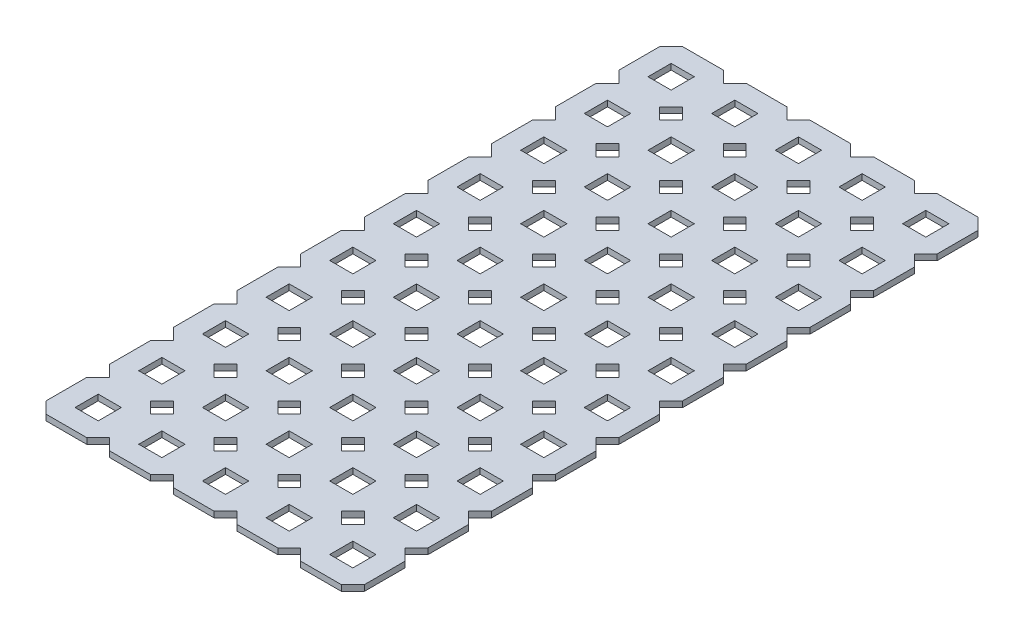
SolidWorks part; units mm, degrees
ref_plane "Front Plane" through (0, 0, 0) normal (0, 0, 1) x (1, 0, 0)
ref_plane "Top Plane" through (0, 0, 0) normal (0, 1, 0) x (1, 0, 0)
ref_plane "Right Plane" through (0, 0, 0) normal (1, 0, 0) x (0, 0, -1)
ref_plane "Plane1" through (0, 1.1684, 0) normal (0, 1, 0) x (1, 0, 0)
sketch "Sketch1" plane through (0, 1.1684, 0) normal (0, 1, 0) x (1, 0, 0)
  line L0 (14.981, 127) -> (12.7, 124.719)
  line L1 (12.7, 124.719) -> (10.419, 127)
  line L2 (10.419, 127) -> (2.281, 127)
  line L3 (2.281, 127) -> (0, 124.719)
  line L4 (0, 124.719) -> (0, 116.581)
  line L5 (0, 116.581) -> (2.281, 114.3)
  line L6 (2.281, 114.3) -> (0, 112.019)
  line L7 (0, 112.019) -> (0, 103.881)
  line L8 (0, 103.881) -> (2.281, 101.6)
  line L9 (2.281, 101.6) -> (0, 99.319)
  line L10 (0, 99.319) -> (0, 91.181)
  line L11 (0, 91.181) -> (2.281, 88.9)
  line L12 (2.281, 88.9) -> (0, 86.619)
  line L13 (0, 86.619) -> (0, 78.481)
  line L14 (0, 78.481) -> (2.281, 76.2)
  line L15 (2.281, 76.2) -> (0, 73.919)
  line L16 (0, 73.919) -> (0, 65.781)
  line L17 (0, 65.781) -> (2.281, 63.5)
  line L18 (2.281, 63.5) -> (0, 61.219)
  line L19 (0, 61.219) -> (0, 53.081)
  line L20 (0, 53.081) -> (2.281, 50.8)
  line L21 (2.281, 50.8) -> (0, 48.519)
  line L22 (0, 48.519) -> (0, 40.381)
  line L23 (0, 40.381) -> (2.281, 38.1)
  line L24 (2.281, 38.1) -> (0, 35.819)
  line L25 (0, 35.819) -> (0, 27.681)
  line L26 (0, 27.681) -> (2.281, 25.4)
  line L27 (2.281, 25.4) -> (0, 23.119)
  line L28 (0, 23.119) -> (0, 14.981)
  line L29 (0, 14.981) -> (2.281, 12.7)
  line L30 (2.281, 12.7) -> (0, 10.419)
  line L31 (0, 10.419) -> (0, 2.281)
  line L32 (0, 2.281) -> (2.281, 0)
  line L33 (2.281, 0) -> (10.419, 0)
  line L34 (10.419, 0) -> (12.7, 2.281)
  line L35 (12.7, 2.281) -> (14.981, 0)
  line L36 (14.981, 0) -> (23.119, 0)
  line L37 (23.119, 0) -> (25.4, 2.281)
  line L38 (25.4, 2.281) -> (27.681, 0)
  line L39 (27.681, 0) -> (35.819, 0)
  line L40 (35.819, 0) -> (38.1, 2.281)
  line L41 (38.1, 2.281) -> (40.381, 0)
  line L42 (40.381, 0) -> (48.519, 0)
  line L43 (48.519, 0) -> (50.8, 2.281)
  line L44 (50.8, 2.281) -> (53.081, 0)
  line L45 (53.081, 0) -> (61.219, 0)
  line L46 (61.219, 0) -> (63.5, 2.281)
  line L47 (63.5, 2.281) -> (63.5, 10.419)
  line L48 (63.5, 10.419) -> (61.219, 12.7)
  line L49 (61.219, 12.7) -> (63.5, 14.981)
  line L50 (63.5, 14.981) -> (63.5, 23.119)
  line L51 (63.5, 23.119) -> (61.219, 25.4)
  line L52 (61.219, 25.4) -> (63.5, 27.681)
  line L53 (63.5, 27.681) -> (63.5, 35.819)
  line L54 (63.5, 35.819) -> (61.219, 38.1)
  line L55 (61.219, 38.1) -> (63.5, 40.381)
  line L56 (63.5, 40.381) -> (63.5, 48.519)
  line L57 (63.5, 48.519) -> (61.219, 50.8)
  line L58 (61.219, 50.8) -> (63.5, 53.081)
  line L59 (63.5, 53.081) -> (63.5, 61.219)
  line L60 (63.5, 61.219) -> (61.219, 63.5)
  line L61 (61.219, 63.5) -> (63.5, 65.781)
  line L62 (63.5, 65.781) -> (63.5, 73.919)
  line L63 (63.5, 73.919) -> (61.219, 76.2)
  line L64 (61.219, 76.2) -> (63.5, 78.481)
  line L65 (63.5, 78.481) -> (63.5, 86.619)
  line L66 (63.5, 86.619) -> (61.219, 88.9)
  line L67 (61.219, 88.9) -> (63.5, 91.181)
  line L68 (63.5, 91.181) -> (63.5, 99.319)
  line L69 (63.5, 99.319) -> (61.219, 101.6)
  line L70 (61.219, 101.6) -> (63.5, 103.881)
  line L71 (63.5, 103.881) -> (63.5, 112.019)
  line L72 (63.5, 112.019) -> (61.219, 114.3)
  line L73 (61.219, 114.3) -> (63.5, 116.581)
  line L74 (63.5, 116.581) -> (63.5, 124.719)
  line L75 (63.5, 124.719) -> (61.219, 127)
  line L76 (61.219, 127) -> (53.081, 127)
  line L77 (53.081, 127) -> (50.8, 124.719)
  line L78 (50.8, 124.719) -> (48.519, 127)
  line L79 (48.519, 127) -> (40.381, 127)
  line L80 (40.381, 127) -> (38.1, 124.719)
  line L81 (38.1, 124.719) -> (35.819, 127)
  line L82 (35.819, 127) -> (27.681, 127)
  line L83 (27.681, 127) -> (25.4, 124.719)
  line L84 (25.4, 124.719) -> (23.119, 127)
  line L85 (23.119, 127) -> (14.981, 127)
  line L86 (12.7, 112.019) -> (10.419, 114.3)
  line L87 (10.419, 114.3) -> (12.7, 116.581)
  line L88 (12.7, 116.581) -> (14.981, 114.3)
  line L89 (14.981, 114.3) -> (12.7, 112.019)
  line L90 (12.7, 86.619) -> (10.419, 88.9)
  line L91 (10.419, 88.9) -> (12.7, 91.181)
  line L92 (12.7, 91.181) -> (14.981, 88.9)
  line L93 (14.981, 88.9) -> (12.7, 86.619)
  line L94 (12.7, 61.219) -> (10.419, 63.5)
  line L95 (10.419, 63.5) -> (12.7, 65.781)
  line L96 (12.7, 65.781) -> (14.981, 63.5)
  line L97 (14.981, 63.5) -> (12.7, 61.219)
  line L98 (12.7, 35.819) -> (10.419, 38.1)
  line L99 (10.419, 38.1) -> (12.7, 40.381)
  line L100 (12.7, 40.381) -> (14.981, 38.1)
  line L101 (14.981, 38.1) -> (12.7, 35.819)
  line L102 (12.7, 10.419) -> (10.419, 12.7)
  line L103 (10.419, 12.7) -> (12.7, 14.981)
  line L104 (12.7, 14.981) -> (14.981, 12.7)
  line L105 (14.981, 12.7) -> (12.7, 10.419)
  line L106 (25.4, 112.019) -> (23.119, 114.3)
  line L107 (23.119, 114.3) -> (25.4, 116.581)
  line L108 (25.4, 116.581) -> (27.681, 114.3)
  line L109 (27.681, 114.3) -> (25.4, 112.019)
  line L110 (25.4, 86.619) -> (23.119, 88.9)
  line L111 (23.119, 88.9) -> (25.4, 91.181)
  line L112 (25.4, 91.181) -> (27.681, 88.9)
  line L113 (27.681, 88.9) -> (25.4, 86.619)
  line L114 (25.4, 61.219) -> (23.119, 63.5)
  line L115 (23.119, 63.5) -> (25.4, 65.781)
  line L116 (25.4, 65.781) -> (27.681, 63.5)
  line L117 (27.681, 63.5) -> (25.4, 61.219)
  line L118 (25.4, 35.819) -> (23.119, 38.1)
  line L119 (23.119, 38.1) -> (25.4, 40.381)
  line L120 (25.4, 40.381) -> (27.681, 38.1)
  line L121 (27.681, 38.1) -> (25.4, 35.819)
  line L122 (25.4, 10.419) -> (23.119, 12.7)
  line L123 (23.119, 12.7) -> (25.4, 14.981)
  line L124 (25.4, 14.981) -> (27.681, 12.7)
  line L125 (27.681, 12.7) -> (25.4, 10.419)
  line L126 (38.1, 112.019) -> (35.819, 114.3)
  line L127 (35.819, 114.3) -> (38.1, 116.581)
  line L128 (38.1, 116.581) -> (40.381, 114.3)
  line L129 (40.381, 114.3) -> (38.1, 112.019)
  line L130 (38.1, 86.619) -> (35.819, 88.9)
  line L131 (35.819, 88.9) -> (38.1, 91.181)
  line L132 (38.1, 91.181) -> (40.381, 88.9)
  line L133 (40.381, 88.9) -> (38.1, 86.619)
  line L134 (38.1, 61.219) -> (35.819, 63.5)
  line L135 (35.819, 63.5) -> (38.1, 65.781)
  line L136 (38.1, 65.781) -> (40.381, 63.5)
  line L137 (40.381, 63.5) -> (38.1, 61.219)
  line L138 (38.1, 35.819) -> (35.819, 38.1)
  line L139 (35.819, 38.1) -> (38.1, 40.381)
  line L140 (38.1, 40.381) -> (40.381, 38.1)
  line L141 (40.381, 38.1) -> (38.1, 35.819)
  line L142 (38.1, 10.419) -> (35.819, 12.7)
  line L143 (35.819, 12.7) -> (38.1, 14.981)
  line L144 (38.1, 14.981) -> (40.381, 12.7)
  line L145 (40.381, 12.7) -> (38.1, 10.419)
  line L146 (50.8, 112.019) -> (48.519, 114.3)
  line L147 (48.519, 114.3) -> (50.8, 116.581)
  line L148 (50.8, 116.581) -> (53.081, 114.3)
  line L149 (53.081, 114.3) -> (50.8, 112.019)
  line L150 (50.8, 86.619) -> (48.519, 88.9)
  line L151 (48.519, 88.9) -> (50.8, 91.181)
  line L152 (50.8, 91.181) -> (53.081, 88.9)
  line L153 (53.081, 88.9) -> (50.8, 86.619)
  line L154 (50.8, 61.219) -> (48.519, 63.5)
  line L155 (48.519, 63.5) -> (50.8, 65.781)
  line L156 (50.8, 65.781) -> (53.081, 63.5)
  line L157 (53.081, 63.5) -> (50.8, 61.219)
  line L158 (50.8, 35.819) -> (48.519, 38.1)
  line L159 (48.519, 38.1) -> (50.8, 40.381)
  line L160 (50.8, 40.381) -> (53.081, 38.1)
  line L161 (53.081, 38.1) -> (50.8, 35.819)
  line L162 (50.8, 10.419) -> (48.519, 12.7)
  line L163 (48.519, 12.7) -> (50.8, 14.981)
  line L164 (50.8, 14.981) -> (53.081, 12.7)
  line L165 (53.081, 12.7) -> (50.8, 10.419)
  line L166 (8.6614, 122.9614) -> (8.6614, 118.3386)
  line L167 (8.6614, 118.3386) -> (4.0386, 118.3386)
  line L168 (4.0386, 118.3386) -> (4.0386, 122.9614)
  line L169 (4.0386, 122.9614) -> (8.6614, 122.9614)
  line L170 (21.3614, 122.9614) -> (21.3614, 118.3386)
  line L171 (21.3614, 118.3386) -> (16.7386, 118.3386)
  line L172 (16.7386, 118.3386) -> (16.7386, 122.9614)
  line L173 (16.7386, 122.9614) -> (21.3614, 122.9614)
  line L174 (34.0614, 122.9614) -> (34.0614, 118.3386)
  line L175 (34.0614, 118.3386) -> (29.4386, 118.3386)
  line L176 (29.4386, 118.3386) -> (29.4386, 122.9614)
  line L177 (29.4386, 122.9614) -> (34.0614, 122.9614)
  line L178 (46.7614, 122.9614) -> (46.7614, 118.3386)
  line L179 (46.7614, 118.3386) -> (42.1386, 118.3386)
  line L180 (42.1386, 118.3386) -> (42.1386, 122.9614)
  line L181 (42.1386, 122.9614) -> (46.7614, 122.9614)
  line L182 (59.4614, 122.9614) -> (59.4614, 118.3386)
  line L183 (59.4614, 118.3386) -> (54.8386, 118.3386)
  line L184 (54.8386, 118.3386) -> (54.8386, 122.9614)
  line L185 (54.8386, 122.9614) -> (59.4614, 122.9614)
  line L186 (8.6614, 110.2614) -> (8.6614, 105.6386)
  line L187 (8.6614, 105.6386) -> (4.0386, 105.6386)
  line L188 (4.0386, 105.6386) -> (4.0386, 110.2614)
  line L189 (4.0386, 110.2614) -> (8.6614, 110.2614)
  line L190 (59.4614, 110.2614) -> (59.4614, 105.6386)
  line L191 (59.4614, 105.6386) -> (54.8386, 105.6386)
  line L192 (54.8386, 105.6386) -> (54.8386, 110.2614)
  line L193 (54.8386, 110.2614) -> (59.4614, 110.2614)
  line L194 (8.6614, 97.5614) -> (8.6614, 92.9386)
  line L195 (8.6614, 92.9386) -> (4.0386, 92.9386)
  line L196 (4.0386, 92.9386) -> (4.0386, 97.5614)
  line L197 (4.0386, 97.5614) -> (8.6614, 97.5614)
  line L198 (59.4614, 97.5614) -> (59.4614, 92.9386)
  line L199 (59.4614, 92.9386) -> (54.8386, 92.9386)
  line L200 (54.8386, 92.9386) -> (54.8386, 97.5614)
  line L201 (54.8386, 97.5614) -> (59.4614, 97.5614)
  line L202 (8.6614, 84.8614) -> (8.6614, 80.2386)
  line L203 (8.6614, 80.2386) -> (4.0386, 80.2386)
  line L204 (4.0386, 80.2386) -> (4.0386, 84.8614)
  line L205 (4.0386, 84.8614) -> (8.6614, 84.8614)
  line L206 (59.4614, 84.8614) -> (59.4614, 80.2386)
  line L207 (59.4614, 80.2386) -> (54.8386, 80.2386)
  line L208 (54.8386, 80.2386) -> (54.8386, 84.8614)
  line L209 (54.8386, 84.8614) -> (59.4614, 84.8614)
  line L210 (8.6614, 72.1614) -> (8.6614, 67.5386)
  line L211 (8.6614, 67.5386) -> (4.0386, 67.5386)
  line L212 (4.0386, 67.5386) -> (4.0386, 72.1614)
  line L213 (4.0386, 72.1614) -> (8.6614, 72.1614)
  line L214 (59.4614, 72.1614) -> (59.4614, 67.5386)
  line L215 (59.4614, 67.5386) -> (54.8386, 67.5386)
  line L216 (54.8386, 67.5386) -> (54.8386, 72.1614)
  line L217 (54.8386, 72.1614) -> (59.4614, 72.1614)
  line L218 (8.6614, 59.4614) -> (8.6614, 54.8386)
  line L219 (8.6614, 54.8386) -> (4.0386, 54.8386)
  line L220 (4.0386, 54.8386) -> (4.0386, 59.4614)
  line L221 (4.0386, 59.4614) -> (8.6614, 59.4614)
  line L222 (59.4614, 59.4614) -> (59.4614, 54.8386)
  line L223 (59.4614, 54.8386) -> (54.8386, 54.8386)
  line L224 (54.8386, 54.8386) -> (54.8386, 59.4614)
  line L225 (54.8386, 59.4614) -> (59.4614, 59.4614)
  line L226 (8.6614, 46.7614) -> (8.6614, 42.1386)
  line L227 (8.6614, 42.1386) -> (4.0386, 42.1386)
  line L228 (4.0386, 42.1386) -> (4.0386, 46.7614)
  line L229 (4.0386, 46.7614) -> (8.6614, 46.7614)
  line L230 (59.4614, 46.7614) -> (59.4614, 42.1386)
  line L231 (59.4614, 42.1386) -> (54.8386, 42.1386)
  line L232 (54.8386, 42.1386) -> (54.8386, 46.7614)
  line L233 (54.8386, 46.7614) -> (59.4614, 46.7614)
  line L234 (8.6614, 34.0614) -> (8.6614, 29.4386)
  line L235 (8.6614, 29.4386) -> (4.0386, 29.4386)
  line L236 (4.0386, 29.4386) -> (4.0386, 34.0614)
  line L237 (4.0386, 34.0614) -> (8.6614, 34.0614)
  line L238 (59.4614, 34.0614) -> (59.4614, 29.4386)
  line L239 (59.4614, 29.4386) -> (54.8386, 29.4386)
  line L240 (54.8386, 29.4386) -> (54.8386, 34.0614)
  line L241 (54.8386, 34.0614) -> (59.4614, 34.0614)
  line L242 (8.6614, 21.3614) -> (8.6614, 16.7386)
  line L243 (8.6614, 16.7386) -> (4.0386, 16.7386)
  line L244 (4.0386, 16.7386) -> (4.0386, 21.3614)
  line L245 (4.0386, 21.3614) -> (8.6614, 21.3614)
  line L246 (59.4614, 21.3614) -> (59.4614, 16.7386)
  line L247 (59.4614, 16.7386) -> (54.8386, 16.7386)
  line L248 (54.8386, 16.7386) -> (54.8386, 21.3614)
  line L249 (54.8386, 21.3614) -> (59.4614, 21.3614)
  line L250 (8.6614, 8.6614) -> (8.6614, 4.0386)
  line L251 (8.6614, 4.0386) -> (4.0386, 4.0386)
  line L252 (4.0386, 4.0386) -> (4.0386, 8.6614)
  line L253 (4.0386, 8.6614) -> (8.6614, 8.6614)
  line L254 (21.3614, 8.6614) -> (21.3614, 4.0386)
  line L255 (21.3614, 4.0386) -> (16.7386, 4.0386)
  line L256 (16.7386, 4.0386) -> (16.7386, 8.6614)
  line L257 (16.7386, 8.6614) -> (21.3614, 8.6614)
  line L258 (34.0614, 8.6614) -> (34.0614, 4.0386)
  line L259 (34.0614, 4.0386) -> (29.4386, 4.0386)
  line L260 (29.4386, 4.0386) -> (29.4386, 8.6614)
  line L261 (29.4386, 8.6614) -> (34.0614, 8.6614)
  line L262 (21.3614, 110.2614) -> (21.3614, 105.6386)
  line L263 (21.3614, 105.6386) -> (16.7386, 105.6386)
  line L264 (16.7386, 105.6386) -> (16.7386, 110.2614)
  line L265 (16.7386, 110.2614) -> (21.3614, 110.2614)
  line L266 (34.0614, 110.2614) -> (34.0614, 105.6386)
  line L267 (34.0614, 105.6386) -> (29.4386, 105.6386)
  line L268 (29.4386, 105.6386) -> (29.4386, 110.2614)
  line L269 (29.4386, 110.2614) -> (34.0614, 110.2614)
  line L270 (46.7614, 110.2614) -> (46.7614, 105.6386)
  line L271 (46.7614, 105.6386) -> (42.1386, 105.6386)
  line L272 (42.1386, 105.6386) -> (42.1386, 110.2614)
  line L273 (42.1386, 110.2614) -> (46.7614, 110.2614)
  line L274 (21.3614, 97.5614) -> (21.3614, 92.9386)
  line L275 (21.3614, 92.9386) -> (16.7386, 92.9386)
  line L276 (16.7386, 92.9386) -> (16.7386, 97.5614)
  line L277 (16.7386, 97.5614) -> (21.3614, 97.5614)
  line L278 (34.0614, 97.5614) -> (34.0614, 92.9386)
  line L279 (34.0614, 92.9386) -> (29.4386, 92.9386)
  line L280 (29.4386, 92.9386) -> (29.4386, 97.5614)
  line L281 (29.4386, 97.5614) -> (34.0614, 97.5614)
  line L282 (46.7614, 97.5614) -> (46.7614, 92.9386)
  line L283 (46.7614, 92.9386) -> (42.1386, 92.9386)
  line L284 (42.1386, 92.9386) -> (42.1386, 97.5614)
  line L285 (42.1386, 97.5614) -> (46.7614, 97.5614)
  line L286 (21.3614, 84.8614) -> (21.3614, 80.2386)
  line L287 (21.3614, 80.2386) -> (16.7386, 80.2386)
  line L288 (16.7386, 80.2386) -> (16.7386, 84.8614)
  line L289 (16.7386, 84.8614) -> (21.3614, 84.8614)
  line L290 (34.0614, 84.8614) -> (34.0614, 80.2386)
  line L291 (34.0614, 80.2386) -> (29.4386, 80.2386)
  line L292 (29.4386, 80.2386) -> (29.4386, 84.8614)
  line L293 (29.4386, 84.8614) -> (34.0614, 84.8614)
  line L294 (46.7614, 84.8614) -> (46.7614, 80.2386)
  line L295 (46.7614, 80.2386) -> (42.1386, 80.2386)
  line L296 (42.1386, 80.2386) -> (42.1386, 84.8614)
  line L297 (42.1386, 84.8614) -> (46.7614, 84.8614)
  line L298 (21.3614, 72.1614) -> (21.3614, 67.5386)
  line L299 (21.3614, 67.5386) -> (16.7386, 67.5386)
  line L300 (16.7386, 67.5386) -> (16.7386, 72.1614)
  line L301 (16.7386, 72.1614) -> (21.3614, 72.1614)
  line L302 (34.0614, 72.1614) -> (34.0614, 67.5386)
  line L303 (34.0614, 67.5386) -> (29.4386, 67.5386)
  line L304 (29.4386, 67.5386) -> (29.4386, 72.1614)
  line L305 (29.4386, 72.1614) -> (34.0614, 72.1614)
  line L306 (46.7614, 72.1614) -> (46.7614, 67.5386)
  line L307 (46.7614, 67.5386) -> (42.1386, 67.5386)
  line L308 (42.1386, 67.5386) -> (42.1386, 72.1614)
  line L309 (42.1386, 72.1614) -> (46.7614, 72.1614)
  line L310 (21.3614, 59.4614) -> (21.3614, 54.8386)
  line L311 (21.3614, 54.8386) -> (16.7386, 54.8386)
  line L312 (16.7386, 54.8386) -> (16.7386, 59.4614)
  line L313 (16.7386, 59.4614) -> (21.3614, 59.4614)
  line L314 (34.0614, 59.4614) -> (34.0614, 54.8386)
  line L315 (34.0614, 54.8386) -> (29.4386, 54.8386)
  line L316 (29.4386, 54.8386) -> (29.4386, 59.4614)
  line L317 (29.4386, 59.4614) -> (34.0614, 59.4614)
  line L318 (46.7614, 59.4614) -> (46.7614, 54.8386)
  line L319 (46.7614, 54.8386) -> (42.1386, 54.8386)
  line L320 (42.1386, 54.8386) -> (42.1386, 59.4614)
  line L321 (42.1386, 59.4614) -> (46.7614, 59.4614)
  line L322 (21.3614, 46.7614) -> (21.3614, 42.1386)
  line L323 (21.3614, 42.1386) -> (16.7386, 42.1386)
  line L324 (16.7386, 42.1386) -> (16.7386, 46.7614)
  line L325 (16.7386, 46.7614) -> (21.3614, 46.7614)
  line L326 (34.0614, 46.7614) -> (34.0614, 42.1386)
  line L327 (34.0614, 42.1386) -> (29.4386, 42.1386)
  line L328 (29.4386, 42.1386) -> (29.4386, 46.7614)
  line L329 (29.4386, 46.7614) -> (34.0614, 46.7614)
  line L330 (46.7614, 46.7614) -> (46.7614, 42.1386)
  line L331 (46.7614, 42.1386) -> (42.1386, 42.1386)
  line L332 (42.1386, 42.1386) -> (42.1386, 46.7614)
  line L333 (42.1386, 46.7614) -> (46.7614, 46.7614)
  line L334 (21.3614, 34.0614) -> (21.3614, 29.4386)
  line L335 (21.3614, 29.4386) -> (16.7386, 29.4386)
  line L336 (16.7386, 29.4386) -> (16.7386, 34.0614)
  line L337 (16.7386, 34.0614) -> (21.3614, 34.0614)
  line L338 (34.0614, 34.0614) -> (34.0614, 29.4386)
  line L339 (34.0614, 29.4386) -> (29.4386, 29.4386)
  line L340 (29.4386, 29.4386) -> (29.4386, 34.0614)
  line L341 (29.4386, 34.0614) -> (34.0614, 34.0614)
  line L342 (46.7614, 34.0614) -> (46.7614, 29.4386)
  line L343 (46.7614, 29.4386) -> (42.1386, 29.4386)
  line L344 (42.1386, 29.4386) -> (42.1386, 34.0614)
  line L345 (42.1386, 34.0614) -> (46.7614, 34.0614)
  line L346 (21.3614, 21.3614) -> (21.3614, 16.7386)
  line L347 (21.3614, 16.7386) -> (16.7386, 16.7386)
  line L348 (16.7386, 16.7386) -> (16.7386, 21.3614)
  line L349 (16.7386, 21.3614) -> (21.3614, 21.3614)
  line L350 (34.0614, 21.3614) -> (34.0614, 16.7386)
  line L351 (34.0614, 16.7386) -> (29.4386, 16.7386)
  line L352 (29.4386, 16.7386) -> (29.4386, 21.3614)
  line L353 (29.4386, 21.3614) -> (34.0614, 21.3614)
  line L354 (59.4614, 8.6614) -> (59.4614, 4.0386)
  line L355 (59.4614, 4.0386) -> (54.8386, 4.0386)
  line L356 (54.8386, 4.0386) -> (54.8386, 8.6614)
  line L357 (54.8386, 8.6614) -> (59.4614, 8.6614)
  line L358 (46.7614, 21.3614) -> (46.7614, 16.7386)
  line L359 (46.7614, 16.7386) -> (42.1386, 16.7386)
  line L360 (42.1386, 16.7386) -> (42.1386, 21.3614)
  line L361 (42.1386, 21.3614) -> (46.7614, 21.3614)
  line L362 (46.7614, 8.6614) -> (46.7614, 4.0386)
  line L363 (46.7614, 4.0386) -> (42.1386, 4.0386)
  line L364 (42.1386, 4.0386) -> (42.1386, 8.6614)
  line L365 (42.1386, 8.6614) -> (46.7614, 8.6614)
  line L366 (50.8, 23.119) -> (48.519, 25.4)
  line L367 (48.519, 25.4) -> (50.8, 27.681)
  line L368 (50.8, 27.681) -> (53.081, 25.4)
  line L369 (53.081, 25.4) -> (50.8, 23.119)
  line L370 (50.8, 48.519) -> (48.519, 50.8)
  line L371 (48.519, 50.8) -> (50.8, 53.081)
  line L372 (50.8, 53.081) -> (53.081, 50.8)
  line L373 (53.081, 50.8) -> (50.8, 48.519)
  line L374 (50.8, 73.919) -> (48.519, 76.2)
  line L375 (48.519, 76.2) -> (50.8, 78.481)
  line L376 (50.8, 78.481) -> (53.081, 76.2)
  line L377 (53.081, 76.2) -> (50.8, 73.919)
  line L378 (50.8, 99.319) -> (48.519, 101.6)
  line L379 (48.519, 101.6) -> (50.8, 103.881)
  line L380 (50.8, 103.881) -> (53.081, 101.6)
  line L381 (53.081, 101.6) -> (50.8, 99.319)
  line L382 (38.1, 23.119) -> (35.819, 25.4)
  line L383 (35.819, 25.4) -> (38.1, 27.681)
  line L384 (38.1, 27.681) -> (40.381, 25.4)
  line L385 (40.381, 25.4) -> (38.1, 23.119)
  line L386 (38.1, 48.519) -> (35.819, 50.8)
  line L387 (35.819, 50.8) -> (38.1, 53.081)
  line L388 (38.1, 53.081) -> (40.381, 50.8)
  line L389 (40.381, 50.8) -> (38.1, 48.519)
  line L390 (38.1, 73.919) -> (35.819, 76.2)
  line L391 (35.819, 76.2) -> (38.1, 78.481)
  line L392 (38.1, 78.481) -> (40.381, 76.2)
  line L393 (40.381, 76.2) -> (38.1, 73.919)
  line L394 (38.1, 99.319) -> (35.819, 101.6)
  line L395 (35.819, 101.6) -> (38.1, 103.881)
  line L396 (38.1, 103.881) -> (40.381, 101.6)
  line L397 (40.381, 101.6) -> (38.1, 99.319)
  line L398 (25.4, 23.119) -> (23.119, 25.4)
  line L399 (23.119, 25.4) -> (25.4, 27.681)
  line L400 (25.4, 27.681) -> (27.681, 25.4)
  line L401 (27.681, 25.4) -> (25.4, 23.119)
  line L402 (25.4, 48.519) -> (23.119, 50.8)
  line L403 (23.119, 50.8) -> (25.4, 53.081)
  line L404 (25.4, 53.081) -> (27.681, 50.8)
  line L405 (27.681, 50.8) -> (25.4, 48.519)
  line L406 (25.4, 73.919) -> (23.119, 76.2)
  line L407 (23.119, 76.2) -> (25.4, 78.481)
  line L408 (25.4, 78.481) -> (27.681, 76.2)
  line L409 (27.681, 76.2) -> (25.4, 73.919)
  line L410 (25.4, 99.319) -> (23.119, 101.6)
  line L411 (23.119, 101.6) -> (25.4, 103.881)
  line L412 (25.4, 103.881) -> (27.681, 101.6)
  line L413 (27.681, 101.6) -> (25.4, 99.319)
  line L414 (12.7, 23.119) -> (10.419, 25.4)
  line L415 (10.419, 25.4) -> (12.7, 27.681)
  line L416 (12.7, 27.681) -> (14.981, 25.4)
  line L417 (14.981, 25.4) -> (12.7, 23.119)
  line L418 (12.7, 48.519) -> (10.419, 50.8)
  line L419 (10.419, 50.8) -> (12.7, 53.081)
  line L420 (12.7, 53.081) -> (14.981, 50.8)
  line L421 (14.981, 50.8) -> (12.7, 48.519)
  line L422 (12.7, 73.919) -> (10.419, 76.2)
  line L423 (10.419, 76.2) -> (12.7, 78.481)
  line L424 (12.7, 78.481) -> (14.981, 76.2)
  line L425 (14.981, 76.2) -> (12.7, 73.919)
  line L426 (12.7, 99.319) -> (10.419, 101.6)
  line L427 (10.419, 101.6) -> (12.7, 103.881)
  line L428 (12.7, 103.881) -> (14.981, 101.6)
  line L429 (14.981, 101.6) -> (12.7, 99.319)
extrude "Boss-Extrude1" add sketch "Sketch1" against normal blind 1.1684
